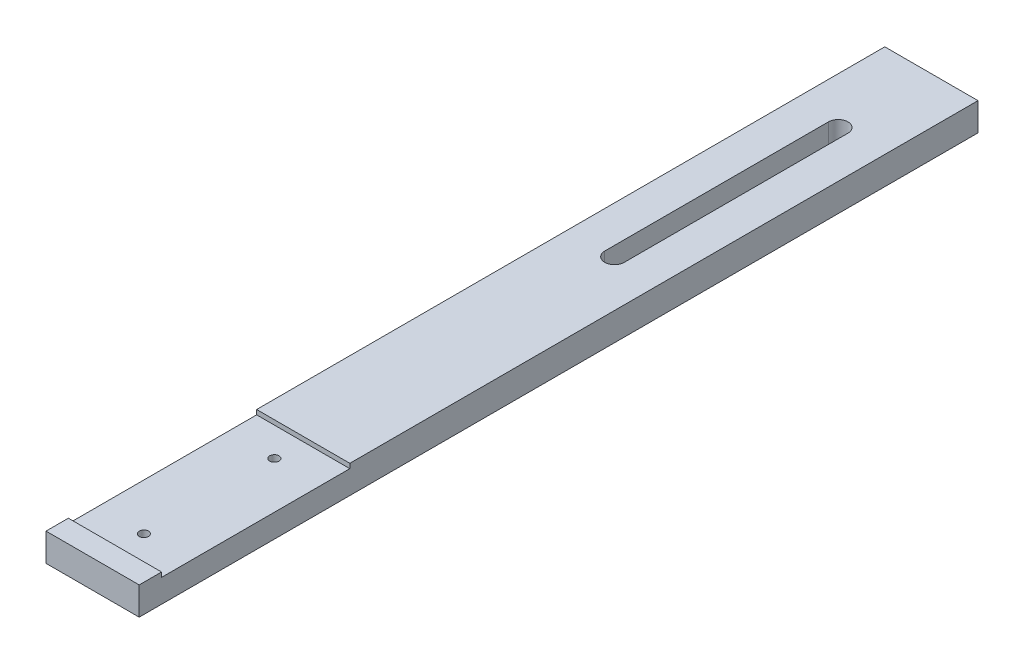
SolidWorks part; units mm, degrees
ref_plane "Plan de face" through (0, 0, 0) normal (0, 0, 1) x (1, 0, 0)
ref_plane "Plan de dessus" through (0, 0, 0) normal (0, 1, 0) x (1, 0, 0)
ref_plane "Plan de droite" through (0, 0, 0) normal (1, 0, 0) x (0, 0, -1)
sketch "Esquisse1" plane through (0, 0, 0) normal (0, 0, 1) x (1, 0, 0)
  line L1 (0, 0) -> (50, 0)
  line L2 (0, 0) -> (0, 15)
  line L3 (0, 15) -> (50, 15)
  line L4 (50, 0) -> (50, 15)
  dimension "D1" = 15
  dimension "D2" = 50
extrude "Extrusion1" add sketch "Esquisse1" along normal blind 450
hole_wizard "Trou taraudé M61" positions "Esquisse3" profile "Esquisse2" tap size "M6" standard "ISO"
sketch "Esquisse3" plane through (0, 15, 0) normal (0, 1, 0) x (-1, 0, 0)
  line L1 (-50, 450) -> (-50, 0) construction
  line L3 (-50, 450) -> (0, 450) construction
  point P0 (-25, 352.5)
  point P1 (-25, 422.5)
  dimension "D1" = 70
  dimension "D2" = 27.5
  dimension "D3" = 25
sketch "Esquisse2" plane through (25, 15, 352.5) normal (1, 0, 0) x (0, 0, 1)
  line L0 (0, 0) -> (0, 15)
  line L1 (0, 15) -> (2.5, 15)
  line L2 (2.5, 15) -> (2.5, 0)
  line L5 (2.5, 0) -> (0, 0)
  line L11 (0, -6.35) -> (0, 107.95) construction
  dimension "Diamètre du trou pour taraudage jusqu'au prochain" = 5
  dimension "Profondeur du trou pour taraudage jusqu'au prochain" = 15
sketch "Esquisse4" plane through (0, 15, 0) normal (0, 1, 0) x (-1, 0, 0)
  line L0 (-25, 170) -> (-25, 50) construction
  line L1 (-30.25, 170) -> (-30.25, 50)
  line L2 (-19.75, 170) -> (-19.75, 50)
  line L3 (-50, 450) -> (-50, 0) construction
  line L4 (-50, 0) -> (0, 0) construction
  arc A0 (-30.25, 170) -> (-19.75, 170) centre (-25, 170) cw
  arc A1 (-30.25, 50) -> (-19.75, 50) centre (-25, 50) ccw
  dimension "D3" = 120
  dimension "D1" = 25
  dimension "D2" = 50
  dimension "D4" = 10.5
extrude "Enlèv. mat.-Extru.1" cut sketch "Esquisse4" against normal through all
sketch "Esquisse5" plane through (50, 0, 0) normal (1, 0, 0) x (0, 0, -1)
  line L0 (-450, 15) -> (0, 15) construction
  line L1 (-438, 15) -> (-337, 15)
  line L2 (-438, 15) -> (-438, 12.5)
  line L3 (-438, 12.5) -> (-337, 12.5)
  line L4 (-337, 15) -> (-337, 12.5)
  line L5 (-450, 0) -> (-450, 15) construction
  dimension "D1" = 12
  dimension "D2" = 101
  dimension "D3" = 2.5
extrude "Enlèv. mat.-Extru.2" cut sketch "Esquisse5" against normal up to next
